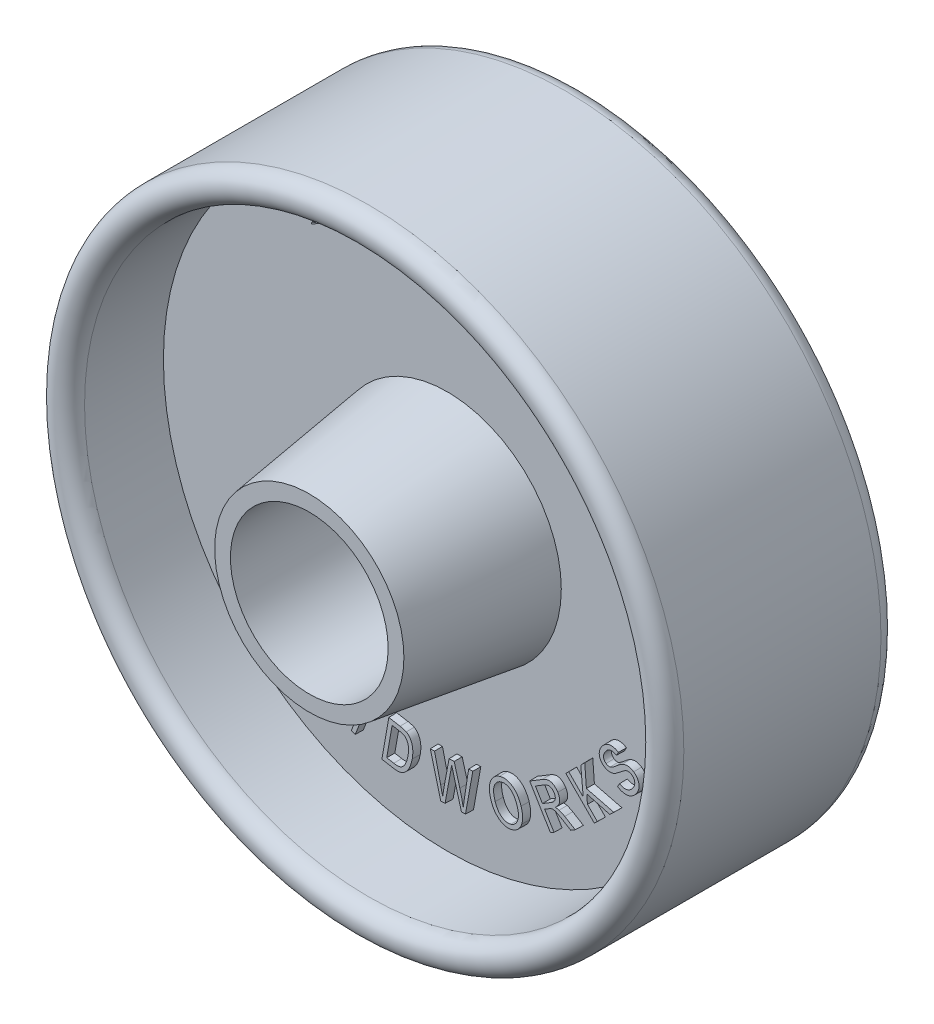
SolidWorks part; units mm, degrees
ref_plane "Front Plane" through (0, 0, 0) normal (0, 0, 1) x (1, 0, 0)
ref_plane "Top Plane" through (0, 0, 0) normal (0, 1, 0) x (1, 0, 0)
ref_plane "Right Plane" through (0, 0, 0) normal (1, 0, 0) x (0, 0, -1)
sketch "Sketch1" plane through (0, 0, 0) normal (1, 0, 0) x (0, 0, -1)
  line L0 (0, -10) -> (0, -40) construction
  line L1 (-20, -10) -> (20, -10)
  line L2 (20, -10) -> (20, -12)
  line L3 (20, -12) -> (2.5, -14.4595)
  line L4 (2.5, -14.4595) -> (2.5, -36)
  line L5 (2.5, -36) -> (12.5, -36)
  line L6 (12.5, -40) -> (-12.5, -40)
  line L7 (0, 0) -> (41.5633, 0) construction
  line L8 (-2.5, -36) -> (-12.5, -36)
  line L9 (-2.5, -14.4595) -> (-2.5, -36)
  line L10 (-20, -12) -> (-2.5, -14.4595)
  line L11 (-20, -10) -> (-20, -12)
  arc A0 (12.5, -36) -> (12.5, -40) centre (12.5, -38) cw
  arc A1 (-12.5, -36) -> (-12.5, -40) centre (-12.5, -38) ccw
  dimension "D1" = 20
  dimension "D2" = 4
  dimension "D3" = 8
  dimension "D4" = 40
  dimension "D5" = 5
  dimension "D6" = 24
  dimension "D7" = 29
  dimension "D8" = 80
revolve "Revolve1" add sketch "Sketch1" angle 360 about L7
sketch "Sketch2" plane through (0, 0, 2.5) normal (0, 0, 1) x (1, 0, 0)
  line L0 (0, 0) -> (0, 49.2755) construction
  line L1 (0, 0) -> (19.2836, 22.9813) construction
  line L2 (0, 0) -> (25.9808, -15) construction
  line L3 (-25.9808, -15) -> (0, 0) construction
  line L4 (0, 0) -> (47.4928, 0) construction
  arc A0 (19.2836, 22.9813) -> (-19.2836, 22.9813) centre (0, 0) ccw construction
  arc A1 (-25.9808, -15) -> (25.9808, -15) centre (0, 0) ccw construction
  text T0 "Designed using" font "Courier New" height in points 11
  text T1 "SOLIDWORKS" font "Arial Narrow" height in points 20
  dimension "D3" = 60
  dimension "D1" = 30
  dimension "D2" = 40
extrude "Boss-Extrude1" add sketch "Sketch2" along normal blind 1 draft 1
